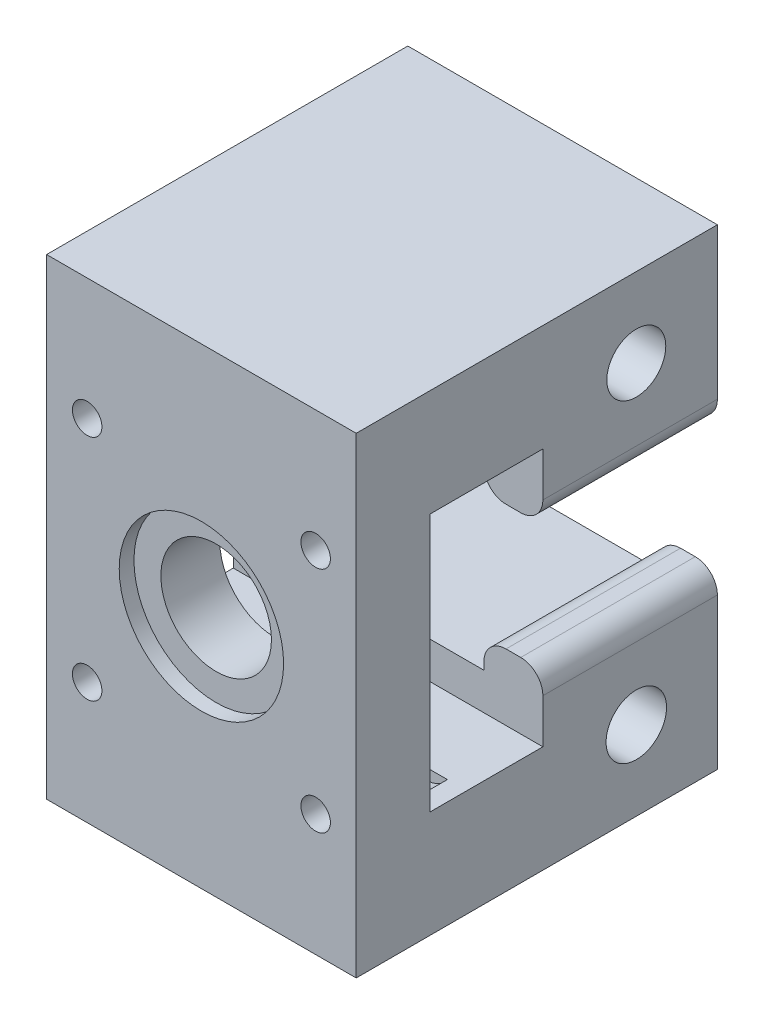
SolidWorks part; units mm, degrees
ref_plane "Plan de face" through (0, 0, 0) normal (0, 0, 1) x (1, 0, 0)
ref_plane "Plan de dessus" through (0, 0, 0) normal (0, 1, 0) x (1, 0, 0)
ref_plane "Plan de droite" through (0, 0, 0) normal (1, 0, 0) x (0, 0, -1)
sketch "Esquisse1" plane through (0, 0, 0) normal (0, 0, 1) x (1, 0, 0)
  line L1 (33.2161, 18.8838) -> (75.2161, 18.8838)
  line L2 (33.2161, 18.8838) -> (33.2161, -45.1162)
  line L3 (33.2161, -45.1162) -> (75.2161, -45.1162)
  line L4 (75.2161, 18.8838) -> (75.2161, -45.1162)
  dimension "D1" = 64
  dimension "D2" = 42
extrude "Boss.-Extru.1" add sketch "Esquisse1" along normal blind 10
sketch "Esquisse2" plane through (0, 0, 0) normal (0, 0, -1) x (-1, 0, 0)
  line L0 (-33.2161, 18.8838) -> (-33.2161, -45.1162) construction
  line L1 (-75.2161, 18.8838) -> (-33.2161, 18.8838)
  line L2 (-75.2161, 18.8838) -> (-75.2161, 0.8838)
  line L3 (-75.2161, 0.8838) -> (-33.2161, 0.8838)
  line L4 (-33.2161, 18.8838) -> (-33.2161, 0.8838)
  dimension "D1" = 18
extrude "Boss.-Extru.2" add sketch "Esquisse2" along normal blind 25
sketch "Esquisse3" plane through (0, 0, 0) normal (0, 0, -1) x (-1, 0, 0)
  line L0 (-33.2161, 0.8838) -> (-33.2161, -45.1162) construction
  line L1 (-75.2161, -45.1162) -> (-33.2161, -45.1162)
  line L2 (-75.2161, -45.1162) -> (-75.2161, -27.1162)
  line L3 (-75.2161, -27.1162) -> (-33.2161, -27.1162)
  line L4 (-33.2161, -45.1162) -> (-33.2161, -27.1162)
  dimension "D1" = 18
extrude "Boss.-Extru.3" add sketch "Esquisse3" along normal blind 25
sketch "Esquisse5" plane through (0, 0, 10) normal (0, 0, 1) x (1, 0, 0)
  circle A0 centre (54.2161, -13.1162) radius 11.15
  dimension "D1" = 22.3
extrude "Enlèv. mat.-Extru.2" cut sketch "Esquisse5" against normal blind 2.5
sketch "Esquisse6" plane through (0, 0, 7.5) normal (0, 0, 1) x (1, 0, 0)
  circle A0 centre (54.2161, -13.1162) radius 3.5
extrude "Enlèv. mat.-Extru.3" cut sketch "Esquisse6" against normal through all
sketch "Esquisse7" plane through (33.2161, 0, 0) normal (-1, 0, 0) x (0, 0, 1)
  line L0 (-25, -27.1162) -> (0, -27.1162) construction
  line L1 (0, 4.3838) -> (-5.3235, 4.3838)
  line L2 (0, 4.3838) -> (0, -30.6162)
  line L3 (0, -30.6162) -> (-5.3235, -30.6162)
  line L4 (-5.3235, 4.3838) -> (-5.3235, -30.6162)
  line L5 (-25, 0.8838) -> (0, 0.8838) construction
  dimension "D1" = 35
  dimension "D2" = 3.5
  dimension "D3" = 3.5
extrude "Enlèv. mat.-Extru.4" cut sketch "Esquisse7" against normal through all
sketch "Esquisse8" plane through (0, 0, 10) normal (0, 0, 1) x (1, 0, 0)
  circle A0 centre (38.7161, 2.3838) radius 2
  circle A1 centre (38.7161, -28.6162) radius 2
  circle A2 centre (69.7161, -28.6162) radius 2
  circle A3 centre (69.7161, 2.3838) radius 2
  circle A4 centre (54.2161, -13.1162) radius 3.5 construction
  dimension "D1" = 4
  dimension "D2" = 4
  dimension "D3" = 4
  dimension "D4" = 4
  dimension "D5" = 31
  dimension "D6" = 31
  dimension "D7" = 31
  dimension "D8" = 31
  dimension "D9" = 15.5
  dimension "D10" = 15.5
  dimension "D11" = 15.5
  dimension "D12" = 15.5
extrude "Enlèv. mat.-Extru.5" cut sketch "Esquisse8" against normal blind 12.5
sketch "Esquisse9" plane through (75.2161, 0, 0) normal (1, 0, 0) x (0, 0, -1)
  line L0 (25, -27.1162) -> (25, -45.1162) construction
  line L1 (25, 18.8838) -> (25, 0.8838) construction
  line L2 (25, 0.8838) -> (5.3235, 0.8838) construction
  line L3 (25, -27.1162) -> (5.3235, -27.1162) construction
  circle A0 centre (18, 8.1338) radius 4
  circle A1 centre (18, -34.3662) radius 4.1
  dimension "D1" = 8.2
  dimension "D2" = 8
  dimension "D3" = 7
  dimension "D4" = 7
  dimension "D5" = 42.5
  dimension "D6" = 7.25
  dimension "D7" = 7.25
extrude "Enlèv. mat.-Extru.7" cut sketch "Esquisse9" against normal through all
sketch "Esquisse10" plane through (0, 0, 7.5) normal (0, 0, 1) x (1, 0, 0)
  circle A0 centre (54.2161, -13.1162) radius 7
extrude "Enlèv. mat.-Extru.8" cut sketch "Esquisse10" against normal through all
sketch "Esquisse11" plane through (0, 0, 7.5) normal (0, 0, 1) x (1, 0, 0)
  circle A0 centre (54.2161, -13.1162) radius 8
extrude "Enlèv. mat.-Extru.9" cut sketch "Esquisse11" against normal blind 10
sketch "Esquisse14" plane through (0, 0, -25) normal (0, 0, -1) x (-1, 0, 0)
  line L1 (-75.2161, -27.1162) -> (-33.2161, -27.1162)
  line L2 (-75.2161, -27.1162) -> (-75.2161, -45.1162)
  line L3 (-75.2161, -45.1162) -> (-33.2161, -45.1162)
  line L4 (-33.2161, -27.1162) -> (-33.2161, -45.1162)
extrude "Boss.-Extru.4" add sketch "Esquisse14" along normal blind 4
sketch "Esquisse15" plane through (0, 0, -25) normal (0, 0, -1) x (-1, 0, 0)
  line L1 (-33.2161, 18.8838) -> (-75.2161, 18.8838)
  line L2 (-33.2161, 18.8838) -> (-33.2161, 0.8838)
  line L3 (-33.2161, 0.8838) -> (-75.2161, 0.8838)
  line L4 (-75.2161, 18.8838) -> (-75.2161, 0.8838)
extrude "Boss.-Extru.5" add sketch "Esquisse15" along normal blind 4
sketch "Esquisse17" plane through (0, 0.8838, 0) normal (0, -1, 0) x (-1, 0, 0)
  line L1 (-33.2161, 29) -> (-75.2161, 29)
  line L2 (-33.2161, 29) -> (-33.2161, 5.3235)
  line L3 (-33.2161, 5.3235) -> (-75.2161, 5.3235)
  line L4 (-75.2161, 29) -> (-75.2161, 5.3235)
extrude "Boss.-Extru.7" add sketch "Esquisse17" along normal blind 1.5
sketch "Esquisse18" plane through (0, -27.1162, 0) normal (0, 1, 0) x (1, 0, 0)
  line L1 (33.2161, 29) -> (75.2161, 29)
  line L2 (33.2161, 29) -> (33.2161, 5.3235)
  line L3 (33.2161, 5.3235) -> (75.2161, 5.3235)
  line L4 (75.2161, 29) -> (75.2161, 5.3235)
extrude "Boss.-Extru.8" add sketch "Esquisse18" along normal blind 1.5
sketch "Esquisse19" plane through (0, -0.6162, 0) normal (0, -1, 0) x (1, 0, 0)
  line L0 (75.2161, -5.3235) -> (33.2161, -5.3235) construction
  line L1 (75.2161, -29) -> (67.2161, -29)
  line L2 (75.2161, -29) -> (75.2161, -5.3235)
  line L3 (75.2161, -5.3235) -> (67.2161, -5.3235)
  line L4 (67.2161, -29) -> (67.2161, -5.3235)
  dimension "D1" = 8
extrude "Boss.-Extru.9" add sketch "Esquisse19" along normal blind 4
sketch "Esquisse20" plane through (0, -0.6162, 0) normal (0, -1, 0) x (1, 0, 0)
  line L0 (67.2161, -5.3235) -> (33.2161, -5.3235) construction
  line L1 (33.2161, -29) -> (41.2161, -29)
  line L2 (33.2161, -29) -> (33.2161, -5.3235)
  line L3 (33.2161, -5.3235) -> (41.2161, -5.3235)
  line L4 (41.2161, -29) -> (41.2161, -5.3235)
  dimension "D1" = 8
extrude "Boss.-Extru.10" add sketch "Esquisse20" along normal blind 4
sketch "Esquisse21" plane through (0, -25.6162, 0) normal (0, 1, 0) x (1, 0, 0)
  line L0 (33.2161, 5.3235) -> (75.2161, 5.3235) construction
  line L1 (75.2161, 29) -> (67.2161, 29)
  line L2 (75.2161, 29) -> (75.2161, 5.3235)
  line L3 (75.2161, 5.3235) -> (67.2161, 5.3235)
  line L4 (67.2161, 29) -> (67.2161, 5.3235)
  dimension "D1" = 8
extrude "Boss.-Extru.11" add sketch "Esquisse21" along normal blind 4
sketch "Esquisse22" plane through (0, -25.6162, 0) normal (0, 1, 0) x (1, 0, 0)
  line L0 (33.2161, 5.3235) -> (67.2161, 5.3235) construction
  line L1 (33.2161, 29) -> (41.2161, 29)
  line L2 (33.2161, 29) -> (33.2161, 5.3235)
  line L3 (33.2161, 5.3235) -> (41.2161, 5.3235)
  line L4 (41.2161, 29) -> (41.2161, 5.3235)
  dimension "D1" = 8
extrude "Boss.-Extru.12" add sketch "Esquisse22" along normal blind 4
fillet "Congé2" radius 3 1 edges at (75.2161, -21.6162, -17.1617)
fillet "Congé3" radius 3 1 edges at (67.2161, -21.6162, -17.1617)
fillet "Congé4" radius 3 1 edges at (67.2161, -4.6162, -17.1617)
fillet "Congé5" radius 3 1 edges at (75.2161, -4.6162, -17.1617)
fillet "Congé6" radius 3 1 edges at (33.2161, -4.6162, -17.1617)
fillet "Congé7" radius 3 1 edges at (41.2161, -4.6162, -17.1617)
fillet "Congé8" radius 3 1 edges at (33.2161, -21.6162, -17.1617)
fillet "Congé9" radius 3 1 edges at (41.2161, -21.6162, -17.1617)
sketch "Esquisse23" plane through (0, 0, 10) normal (0, 0, 1) x (1, 0, 0)
  line L1 (33.2161, -45.1162) -> (75.2161, -45.1162)
  line L2 (33.2161, -45.1162) -> (33.2161, 18.8838)
  line L3 (33.2161, 18.8838) -> (75.2161, 18.8838)
  line L4 (75.2161, -45.1162) -> (75.2161, 18.8838)
extrude "Boss.-Extru.13" add sketch "Esquisse23" along normal blind 10
sketch "Esquisse24" plane through (0, 0, 0) normal (0, 0, -1) x (-1, 0, 0)
  line L0 (-38.7161, 4.3838) -> (-33.2161, 4.3838) construction
  line L1 (-75.2161, -30.6162) -> (-33.2161, -30.6162)
  line L2 (-75.2161, -30.6162) -> (-75.2161, 4.3838)
  line L3 (-75.2161, 4.3838) -> (-33.2161, 4.3838)
  line L4 (-33.2161, -30.6162) -> (-33.2161, 4.3838)
  line L5 (-33.2161, 4.3838) -> (-33.2161, -30.6162) construction
extrude "Enlèv. mat.-Extru.10" cut sketch "Esquisse24" against normal blind 10
sketch "Esquisse26" plane through (0, 0, 20) normal (0, 0, 1) x (1, 0, 0)
  circle A0 centre (54.2161, -13.1162) radius 11.15
extrude "Enlèv. mat.-Extru.11" cut sketch "Esquisse26" against normal blind 2
sketch "Esquisse27" plane through (0, 0, 18) normal (0, 0, 1) x (1, 0, 0)
  circle A0 centre (54.2161, -13.1162) radius 7.5
extrude "Enlèv. mat.-Extru.12" cut sketch "Esquisse27" against normal through all
sketch "Esquisse28" plane through (0, 0, 20) normal (0, 0, 1) x (1, 0, 0)
  circle A0 centre (38.7161, -28.6162) radius 2
  circle A1 centre (38.7161, 2.3838) radius 2
  circle A2 centre (69.7161, 2.3838) radius 2
  circle A3 centre (69.7161, -28.6162) radius 2
  circle A4 centre (54.2161, -13.1162) radius 7.5 construction
  circle A5 centre (54.2161, -13.1162) radius 11.15 construction
  dimension "D9" = 4
  dimension "D10" = 4
  dimension "D11" = 4
  dimension "D12" = 4
  dimension "D2" = 15.5
  dimension "D13" = 15.5
  dimension "D14" = 15.5
  dimension "D1" = 31
  dimension "D3" = 31
  dimension "D4" = 31
  dimension "D5" = 15.5
  dimension "D6" = 15.5
  dimension "D7" = 15.5
  dimension "D8" = 15.5
sketch "Esquisse29" plane through (0, -21.6162, 0) normal (0, 1, 0) x (1, 0, 0)
  line L1 (27.8666, 33.8882) -> (45.1398, 33.8882)
  line L2 (27.8666, 33.8882) -> (27.8666, 3.5597)
  line L3 (27.8666, 3.5597) -> (45.1398, 3.5597)
  line L4 (45.1398, 33.8882) -> (45.1398, 3.5597)
extrude "Enlèv. mat.-Extru.14" cut sketch "Esquisse29" against normal blind 4
sketch "Esquisse30" plane through (0, -4.6162, 0) normal (0, -1, 0) x (1, 0, 0)
  line L1 (44.5493, -30.4616) -> (28.9971, -30.4616)
  line L2 (44.5493, -30.4616) -> (44.5493, -3.4722)
  line L3 (44.5493, -3.4722) -> (28.9971, -3.4722)
  line L4 (28.9971, -30.4616) -> (28.9971, -3.4722)
extrude "Enlèv. mat.-Extru.15" cut sketch "Esquisse30" against normal blind 4
extrude "Enlèv. mat.-Extru.16" cut sketch "Esquisse28" against normal blind 10
sketch "Esquisse31" plane through (0, 0, 10) normal (0, 0, -1) x (-1, 0, 0)
  circle A0 centre (-69.7161, 2.3838) radius 3.4475
  circle A1 centre (-38.7161, 2.3838) radius 3.5
  circle A2 centre (-38.7161, -28.6162) radius 3.5
  circle A3 centre (-69.7161, -28.6162) radius 3.5
extrude "Enlèv. mat.-Extru.17" cut sketch "Esquisse31" along normal blind 5
